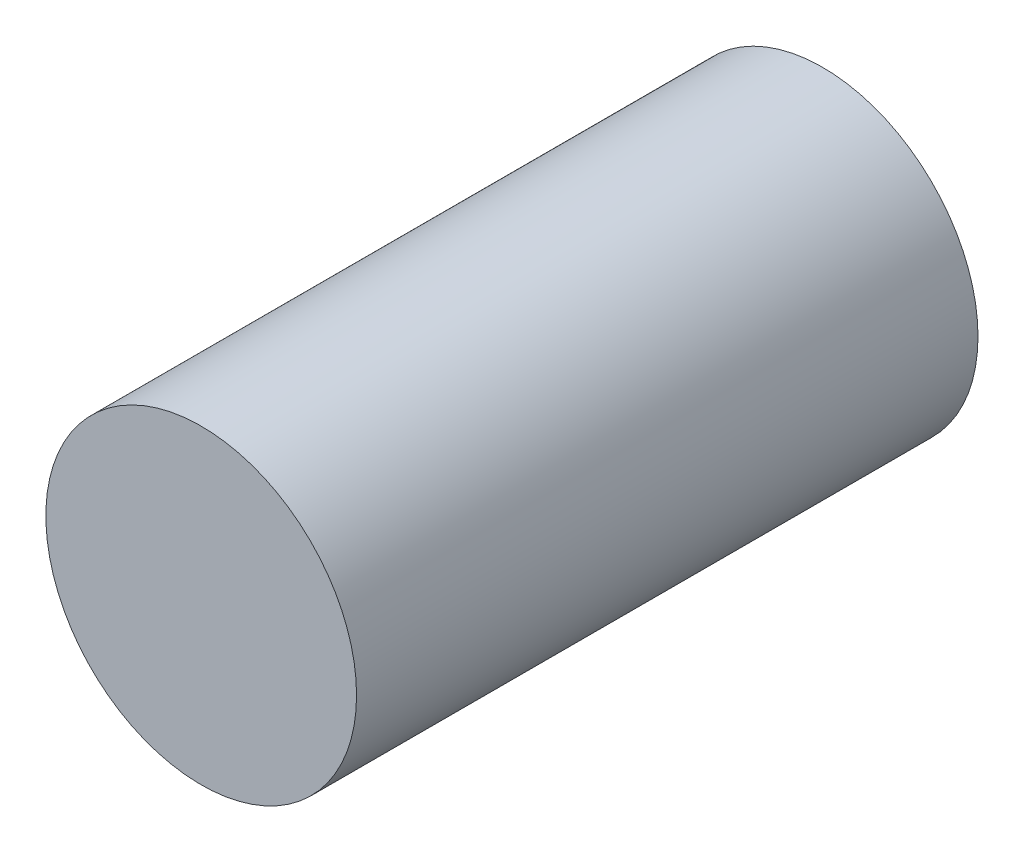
SolidWorks part; units mm, degrees
ref_plane "Ön Düzlem" through (0, 0, 0) normal (0, 0, 1) x (1, 0, 0)
ref_plane "Üst Düzlem" through (0, 0, 0) normal (0, 1, 0) x (1, 0, 0)
ref_plane "Sağ Düzlem" through (0, 0, 0) normal (1, 0, 0) x (0, 0, -1)
sketch "Çizim1" plane through (0, 0, 0) normal (0, 0, 1) x (1, 0, 0)
  circle A0 centre (0, 0) radius 4
  dimension "D1" = 8
extrude "Yükseklik-Ekstrüzyon1" add sketch "Çizim1" along normal blind 16
